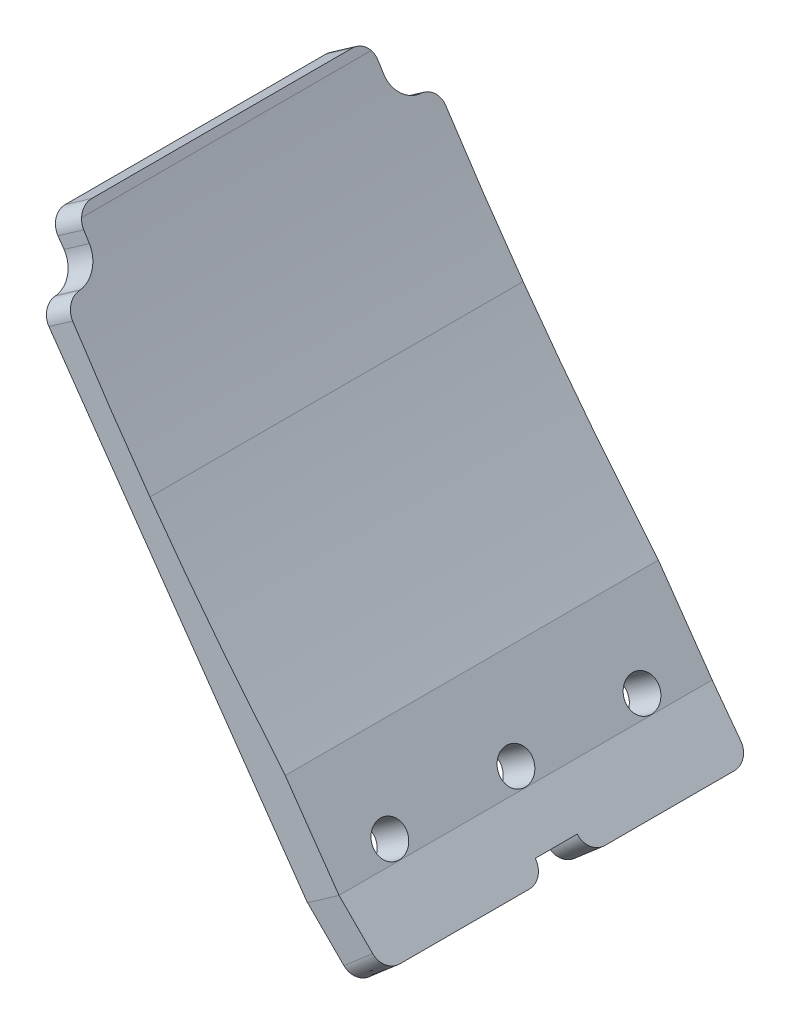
SolidWorks part; units mm, degrees
ref_plane "Plan de face" through (0, 0, 0) normal (0, 0, 1) x (1, 0, 0)
ref_plane "Plan de dessus" through (0, 0, 0) normal (0, 1, 0) x (1, 0, 0)
ref_plane "Plan de droite" through (0, 0, 0) normal (1, 0, 0) x (0, 0, -1)
sketch "Esquisse1" plane through (0, 0, 0) normal (0, 0, 1) x (1, 0, 0)
  line L0 (1.4721, -209.7916) -> (4.6344, -207.5809)
  line L1 (5.1586, -208.4345) -> (4.6344, -207.5809)
  line L2 (1.4721, -209.7916) -> (-0.8227, -211.3959) construction
  line L3 (3.3445, -212.4699) -> (1.4721, -209.7916) construction
  line L4 (3.3445, -212.4699) -> (1.4721, -209.7916)
  line L5 (5.0998, -214.9806) -> (3.3445, -212.4699) construction
  line L6 (5.0998, -214.9806) -> (3.3445, -212.4699)
  line L7 (5.0998, -214.9806) -> (36.9958, -260.6056) construction
  line L8 (5.0998, -214.9806) -> (36.9958, -260.6056)
  line L9 (1.4721, -209.7916) -> (5.4567, -207.006) construction
  line L11 (5.0998, -214.9806) -> (36.9958, -260.6056) construction
  line L12 (5.9193, -214.4077) -> (37.8154, -260.0326) construction
  line L13 (4.1641, -211.8969) -> (2.8647, -210.0382) construction
  line L14 (2.8647, -210.0382) -> (5.1586, -208.4345) construction
  line L15 (5.9193, -214.4077) -> (4.1641, -211.8969) construction
  line L16 (36.9958, -260.6056) -> (40.7553, -257.9774)
  line L18 (34.3556, -248.8232) -> (40.7553, -257.9774)
  line L19 (59.3678, -244.9655) -> (38.7989, -259.3451) construction
  spline S0 degree 3 poles (50.7887, -2995.9862) (515.8528, 4740.9635) (-1407.6654, -4032.3973) (2037.9707, 1861.2077) knots -6.882276 -6.882276 -6.882276 -6.882276 5.71063 5.71063 5.71063 5.71063 only from (-60.6571, -15.6153) to (19.0709, -227.5931) construction
  spline S1 degree 3 poles (5.4567, -207.006) (9.7887, -214.1079) (14.3247, -220.9784) (19.0709, -227.5931) knots 0.883785 0.883785 0.883785 0.883785 1 1 1 1 construction
  spline S2 degree 1 poles (5.1586, -208.4345) (18.2584, -228.1761) knots 0 0 1 1 construction
  spline S3 degree 3 poles (5.1586, -208.4345) (7.2359, -211.817) (11.5282, -218.5453) (15.9677, -224.9836) (18.2584, -228.1761) knots 0.888729 0.888729 0.888729 0.888729 0.944365 1 1 1 1
  spline S4 degree 3 poles (2281.31, -2187.6716) (-99.8902, 138.589) (-31.3702, -610.7071) (808.6992, -321.0792) (367.5506, -3116.056) knots -2.578741 -2.578741 -2.578741 -2.578741 0.881729 8.197892 8.197892 8.197892 8.197892 only from (18.2584, -228.1761) to (34.3556, -248.8232) construction
  spline S5 degree 3 poles (18.2584, -228.1761) (20.027, -230.641) (25.2572, -237.715) (30.7045, -244.4967) (34.3556, -248.8232) knots 0.819229 0.819229 0.819229 0.819229 0.881729 1 1 1 1
  dimension "D1" = 1
sketch "Esquisse2" plane through (0, 0, 0) normal (0, 0, 1) x (1, 0, 0)
  line L0 (5.1586, -208.4345) -> (4.6344, -207.5809) construction
  line L2 (5.0998, -214.9806) -> (36.9958, -260.6056) construction
  line L3 (5.0998, -214.9806) -> (3.3445, -212.4699) construction
  line L4 (3.3445, -212.4699) -> (1.4721, -209.7916) construction
  line L5 (1.4721, -209.7916) -> (4.6344, -207.5809) construction
  line L6 (5.1586, -208.4345) -> (4.6344, -207.5809)
  line L7 (36.9958, -260.6056) -> (40.7553, -257.9774) construction
  line L8 (5.0998, -214.9806) -> (36.9958, -260.6056)
  line L9 (5.0998, -214.9806) -> (3.3445, -212.4699)
  line L10 (3.3445, -212.4699) -> (1.4721, -209.7916)
  line L11 (1.4721, -209.7916) -> (4.6344, -207.5809)
  line L12 (34.3556, -248.8232) -> (40.7553, -257.9774) construction
  line L13 (36.9958, -260.6056) -> (40.7553, -257.9774)
  line L14 (34.3556, -248.8232) -> (40.7553, -257.9774)
  spline S0 degree 3 poles (636.7087, -983.7678) (-82.3762, 25.1798) (-22.6744, -253.3262) (137.1599, -334.5297) (700.4459, -959.3503) knots -0.626438 -0.626438 -0.626438 -0.626438 0.944365 2.276208 2.276208 2.276208 2.276208 only from (5.1586, -208.4345) to (18.2584, -228.1761) construction
  spline S2 degree 3 poles (5.1586, -208.4345) (7.2359, -211.817) (11.5282, -218.5453) (15.9677, -224.9836) (18.2584, -228.1761) knots 0.888729 0.888729 0.888729 0.888729 0.944365 1 1 1 1
  spline S3 degree 3 poles (830.9606, -810.8544) (-82.1764, 16.3113) (9.1675, -427.9805) (451.1044, -400.1841) (517.0012, -1124.6384) knots -1.643105 -1.643105 -1.643105 -1.643105 0.881729 5.621346 5.621346 5.621346 5.621346 only from (18.2584, -228.1761) to (34.3556, -248.8232) construction
  spline S4 degree 3 poles (18.2584, -228.1761) (20.027, -230.641) (25.2572, -237.715) (30.7045, -244.4967) (34.3556, -248.8232) knots 0.819229 0.819229 0.819229 0.819229 0.881729 1 1 1 1
extrude "Extrusion3" add sketch "Esquisse2" along normal up to surface and the other way up to surface
sketch "Esquisse3" plane through (0, 0, 0) normal (0, 0, 1) x (1, 0, 0)
  line L0 (122.326, -359.4385) -> (37.0078, -260.5972) construction
  line L1 (42.2592, -266.681) -> (37.0078, -260.5972)
  line L2 (40.7553, -257.9774) -> (45.7025, -263.7088)
  line L3 (37.0078, -260.5972) -> (40.7553, -257.9774)
  line L4 (42.2592, -266.681) -> (45.7025, -263.7088)
  line L5 (36.9958, -260.6056) -> (40.7553, -257.9774) construction
  dimension "D2" = 70
extrude "Extrusion4" add sketch "Esquisse3" against normal up to surface and the other way up to surface
sketch "Esquisse6" plane through (-97.5271, -68.1804, 0) normal (-0.8196, -0.573, 0) x (0, 0, 1)
  line L0 (0, -223.6153) -> (0, -234.7847) construction
  circle A0 centre (-15, -232.7847) radius 1.95
  circle A3 centre (15, -232.7847) radius 1.95
  circle A4 centre (0, -232.7847) radius 1.95
  dimension "D1" = 3.9
  dimension "D2" = 3.9
extrude "Extrusion6" cut sketch "Esquisse6" against normal blind 10
sketch "Esquisse8" plane through (-97.5271, -68.1804, 0) normal (-0.8196, -0.573, 0) x (0, 0, 1)
  line L0 (-17.5, -176.0526) -> (-17.5, -172.7847) construction
  line L1 (-17.5, -176.0526) -> (-17.5, -172.7847)
  line L2 (-22.2, -178.6698) -> (-22.2, -172.7847)
  line L3 (-22.2, -172.7847) -> (-22.2, -234.7847) construction
  line L4 (-22.2, -172.7847) -> (-17.5, -172.7847)
  line L5 (17.5, -176.0526) -> (17.5, -172.7847) construction
  line L6 (17.5, -176.0526) -> (17.5, -172.7847)
  line L8 (17.5, -172.7847) -> (22.2, -172.7847)
  line L9 (22.2, -172.7847) -> (-22.2, -172.7847) construction
  line L10 (22.2, -172.7847) -> (22.2, -178.6698)
  ellipse E0 centre (-20.2, -178.6698) end of major axis (-18.2, -178.6698) minor radius 0.4617 (-22.2, -178.6698) -> (-20.5, -179.1263) ccw construction
  ellipse E1 centre (-20.5, -176.0526) end of major axis (-20.5, -179.1315) minor radius 3 (-20.2, -179.1161) -> (-17.5, -176.0526) ccw construction
  ellipse E2 centre (-20.2, -178.6698) end of major axis (-18.2, -178.6698) minor radius 0.4617 (-22.2, -178.6698) -> (-20.5, -179.1263) ccw
  ellipse E3 centre (-20.5, -176.0526) end of major axis (-20.5, -179.1315) minor radius 3 (-20.2, -179.1161) -> (-17.5, -176.0526) ccw
  ellipse E4 centre (20.2, -178.6698) end of major axis (18.2, -178.6698) minor radius 0.4617 (20.5, -179.1263) -> (22.2, -178.6698) ccw construction
  ellipse E5 centre (20.5, -176.0526) end of major axis (20.5, -172.9737) minor radius 3 (17.5, -176.0526) -> (20.2, -179.1161) ccw construction
  ellipse E6 centre (20.2, -178.6698) end of major axis (18.2, -178.6698) minor radius 0.4617 (20.5, -179.1263) -> (22.2, -178.6698) ccw
  ellipse E7 centre (20.5, -176.0526) end of major axis (20.5, -172.9737) minor radius 3 (17.5, -176.0526) -> (20.2, -179.1161) ccw
  spline S0 degree 3 poles (-288.6584, -2154.6801) (282.9708, 2133.5464) (-113.0942, -2427.2124) (23.7128, 1820.2086) knots -286.056226 -286.056226 -286.056226 -286.056226 197.380444 197.380444 197.380444 197.380444 only from (20.5, -179.1263) to (20.2, -179.1161) construction
  spline S1 degree 3 poles (20.5, -179.1263) (20.4003, -179.1298) (20.3003, -179.1264) (20.2, -179.1161) knots 0 0 0 0 1 1 1 1
  spline S2 degree 3 poles (-23.7131, 1820.2183) (113.0954, -2427.2376) (-282.9746, 2133.5889) (288.6658, -2154.7354) knots -196.380814 -196.380814 -196.380814 -196.380814 287.058303 287.058303 287.058303 287.058303 only from (-20.2, -179.1161) to (-20.5, -179.1263) construction
  spline S3 degree 3 poles (-20.2, -179.1161) (-20.3003, -179.1264) (-20.4003, -179.1298) (-20.5, -179.1263) knots 0 0 0 0 1 1 1 1
extrude "Enlèv. mat.-Extru.4" cut sketch "Esquisse8" against normal through all
sketch "Esquisse10" plane through (-104.2508, -89.9876, 0) normal (0.757, 0.6534, 0) x (0, 0, -1)
  line L0 (0, -229.4887) -> (0, -209.8165) construction
  line L1 (21.8048, -229.4887) -> (-21.8048, -229.4887) construction
  line L2 (0, -166.071) -> (0, -221.4504) construction
  line L4 (-2.5, -229.4887) -> (2.5, -229.4887)
  line L5 (-2.5, -229.4887) -> (-2.5, -227.4887)
  line L6 (-2.5, -227.4887) -> (2.5, -227.4887)
  line L7 (2.5, -229.4887) -> (2.5, -227.4887)
  dimension "D1" = 5
  dimension "D2" = 2
extrude "Extrusion8" cut sketch "Esquisse10" against normal through all
fillet "Congé1" radius 2 8 edges at (3.0533, -208.6862, 17.5) (3.0533, -208.6862, -17.5) (6.296, -213.5998, -22.2) (6.296, -213.5998, 22.2) (43.9809, -265.1949, 2.5) (43.9809, -265.1949, -2.5)
